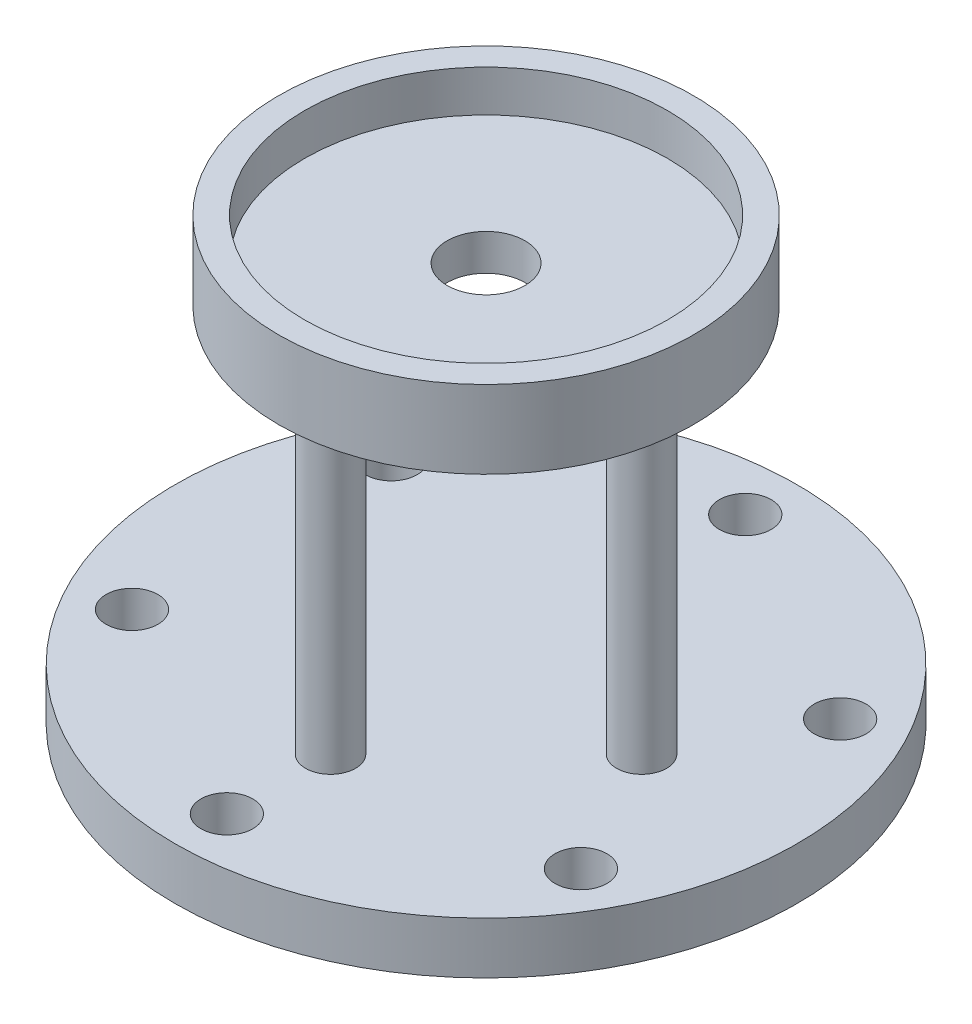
SolidWorks part; units mm, degrees
ref_plane "前视基准面" through (0, 0, 0) normal (0, 0, 1) x (1, 0, 0)
ref_plane "上视基准面" through (0, 0, 0) normal (0, 1, 0) x (1, 0, 0)
ref_plane "右视基准面" through (0, 0, 0) normal (1, 0, 0) x (0, 0, -1)
other "Configuration Table"
sketch "草图1" plane through (0, 0, 0) normal (0, 1, 0) x (1, 0, 0)
  circle A0 centre (0, 0) radius 60
  circle A1 centre (0, 50) radius 5
  circle A2 centre (43.3013, 25) radius 5
  circle A3 centre (43.3013, -25) radius 5
  circle A4 centre (0, -50) radius 5
  circle A5 centre (-43.3013, -25) radius 5
  circle A6 centre (-43.3013, 25) radius 5
  dimension "D1" = 10
  dimension "D2" = 120
  dimension "D3" = 43.3013
  dimension "D4" = 43.3013
  dimension "D5" = 25
  dimension "D6" = 50
  dimension "D7" = 25
  dimension "D8" = 50
extrude "Base_D120_T10_6xD10_PCD100" add sketch "草图1" along normal blind 10
sketch "草图2" plane through (0, 0, 0) normal (0, 1, 0) x (1, 0, 0)
  circle A0 centre (0, -30) radius 4.8181
  circle A1 centre (30, 0) radius 4.8181
  circle A2 centre (0, 30) radius 4.8181
  circle A3 centre (-30, 0) radius 4.8181
  dimension "D1" = 9.6362
  dimension "D2" = 30
  dimension "D3" = 30
  dimension "D4" = 30
  dimension "D5" = 30
extrude "Four_Original_Support_Posts_L60" add sketch "草图2" along normal blind 60 from offset 10
sketch "草图3" plane through (0, 0, 0) normal (0, 1, 0) x (1, 0, 0)
  circle A0 centre (0, 0) radius 40
  circle A1 centre (0, 0) radius 7.5
  dimension "D1" = 15
  dimension "D2" = 80
extrude "Upper_Support_D80_Through_D15" add sketch "草图3" along normal blind 7 from offset 70
sketch "草图4" plane through (0, 0, 0) normal (0, 1, 0) x (1, 0, 0)
  circle A0 centre (0, 0) radius 40
  circle A1 centre (0, 0) radius 35
  dimension "D1" = 70
  dimension "D2" = 80
extrude "Bearing_Cup_D80_D70_Depth8" add sketch "草图4" along normal blind 8 from offset 77
